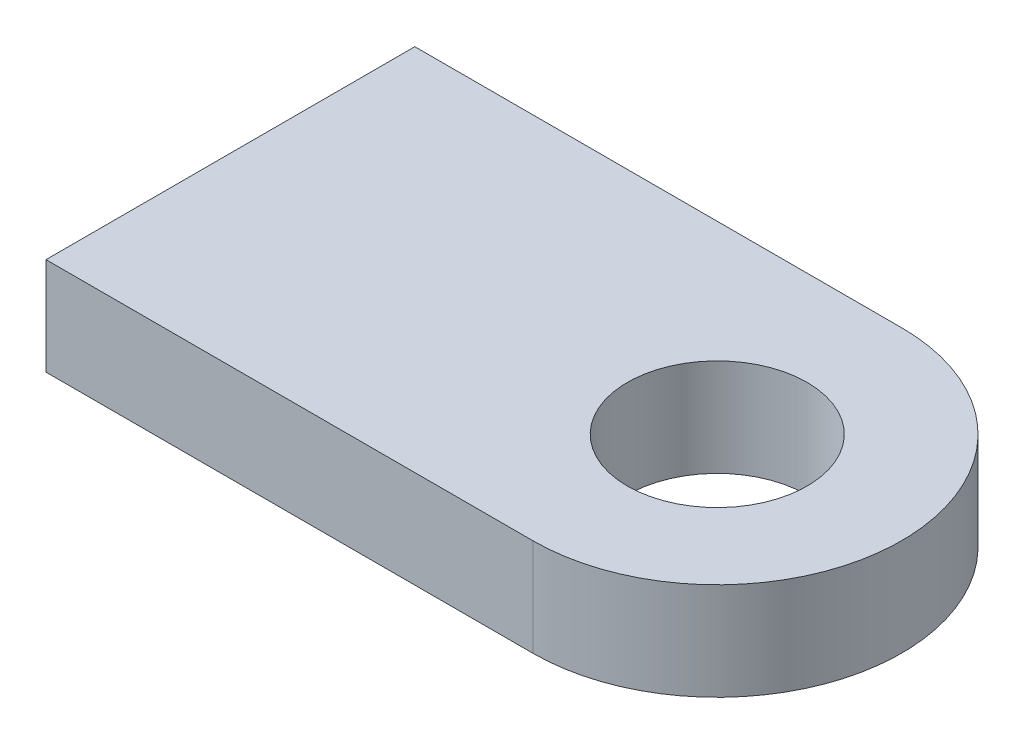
SolidWorks part; units mm, degrees
ref_plane "Front Plane" through (0, 0, 0) normal (0, 0, 1) x (1, 0, 0)
ref_plane "Top Plane" through (0, 0, 0) normal (0, 1, 0) x (1, 0, 0)
ref_plane "Right Plane" through (0, 0, 0) normal (1, 0, 0) x (0, 0, -1)
sketch "Sketch1" plane through (0, 0, 0) normal (0, 1, 0) x (1, 0, 0)
  line L0 (-99.9007, -37.8463) -> (-99.9007, 37.8463)
  line L1 (-99.9007, 37.8463) -> (0, 37.8463)
  line L2 (0, -37.8463) -> (-99.9007, -37.8463)
  arc A0 (0, 37.8463) -> (0, -37.8463) centre (0, 0) cw
  circle A1 centre (0, 0) radius 18.4412
extrude "Extrude1" add sketch "Sketch1" along normal blind 20
